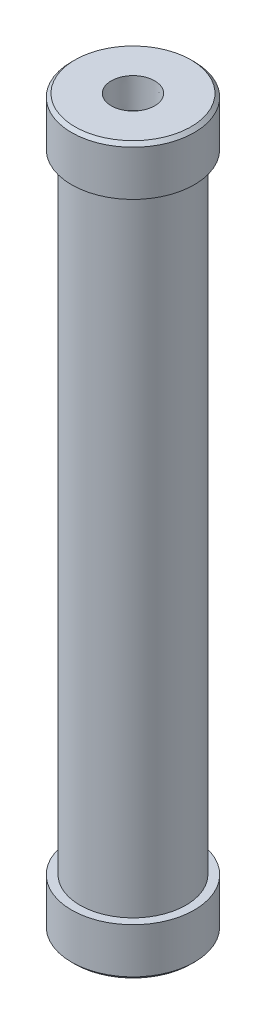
SolidWorks part; units mm, degrees
ref_plane "Front Plane" through (0, 0, 0) normal (0, 0, 1) x (1, 0, 0)
ref_plane "Top Plane" through (0, 0, 0) normal (0, 1, 0) x (1, 0, 0)
ref_plane "Right Plane" through (0, 0, 0) normal (1, 0, 0) x (0, 0, -1)
sketch "Sketch1" plane through (0, 0, 0) normal (0, 1, 0) x (1, 0, 0)
  circle A0 centre (0, 0) radius 24.13
  circle A1 centre (0, 0) radius 20.32
  dimension "D1" = 48.26
  dimension "D2" = 3.81
extrude "Boss-Extrude1" add sketch "Sketch1" along normal blind 330.2
sketch "Sketch2" plane through (0, 0, 0) normal (0, 1, 0) x (1, 0, 0)
  circle A0 centre (0, 0) radius 27.94
  dimension "D1" = 55.88
extrude "Boss-Extrude2" add sketch "Sketch2" along normal blind 22.098
ref_plane "Plane1" through (0, 330.2, 0) normal (0, 1, 0) x (1, 0, 0)
sketch "Sketch3" plane through (0, 330.2, 0) normal (0, 1, 0) x (1, 0, 0)
  circle A0 centre (0, 0) radius 27.94
  dimension "D1" = 55.88
extrude "Boss-Extrude3" add sketch "Sketch3" against normal blind 22.098
hole_wizard "1/2 NPT Tapped Hole1" positions "Sketch5" profile "Sketch4" size "1/2" standard "ANSI Inch"
sketch "Sketch5" plane through (0, 330.2, 0) normal (0, 1, 0) x (1, 0, 0)
  point P0 (0, 0)
sketch "Sketch4" plane through (0, 330.2, 0) normal (1, 0, 0) x (0, 0, 1)
  line L0 (0, 0) -> (0, 27.9705)
  line L1 (8.9281, 22.606) -> (0, 27.9705)
  line L2 (-8.9281, 22.606) -> (0, 27.9705) construction
  line L3 (8.9281, 22.606) -> (8.9281, 13.462)
  line L4 (8.9281, 13.462) -> (9.4797, 13.462)
  line L5 (9.4797, 13.462) -> (9.8828, 0)
  line L6 (-9.4797, 13.462) -> (-9.8828, 0) construction
  line L7 (9.8828, 0) -> (0, 0)
  line L8 (0, -6.35) -> (0, 107.95) construction
  line L11 (-8.9281, 13.462) -> (-9.4797, 13.462) construction
  dimension "Tap Drill Dia." = 17.8562
  dimension "Tap Drill Depth" = 22.606
  dimension "Thread Dia." = 19.7656
  dimension "Thread Angle" = 3.43
  dimension "Thread Depth" = 13.462
  dimension "Drill Angle" = 118
hole_wizard "1/2 NPT Tapped Hole2" positions "Sketch7" profile "Sketch6" size "1/2" standard "ANSI Inch"
sketch "Sketch7" plane through (0, 0, 0) normal (0, 1, 0) x (1, 0, 0)
  point P0 (0, 0)
sketch "Sketch6" plane through (0, 0, 0) normal (1, 0, 0) x (0, 0, -1)
  line L0 (0, 0) -> (0, 27.9705)
  line L1 (8.9281, 22.606) -> (0, 27.9705)
  line L2 (-8.9281, 22.606) -> (0, 27.9705) construction
  line L3 (8.9281, 22.606) -> (8.9281, 13.462)
  line L4 (8.9281, 13.462) -> (9.4797, 13.462)
  line L5 (9.4797, 13.462) -> (9.8828, 0)
  line L6 (-9.4797, 13.462) -> (-9.8828, 0) construction
  line L7 (9.8828, 0) -> (0, 0)
  line L8 (0, -6.35) -> (0, 107.95) construction
  line L11 (-8.9281, 13.462) -> (-9.4797, 13.462) construction
  dimension "Tap Drill Dia." = 17.8562
  dimension "Tap Drill Depth" = 22.606
  dimension "Thread Dia." = 19.7656
  dimension "Thread Angle" = 3.43
  dimension "Thread Depth" = 13.462
  dimension "Drill Angle" = 118
chamfer "Chamfer1" distance 1.524 angle 45 2 edges at (0, 0, 27.94) (0, 330.2, 27.94)
